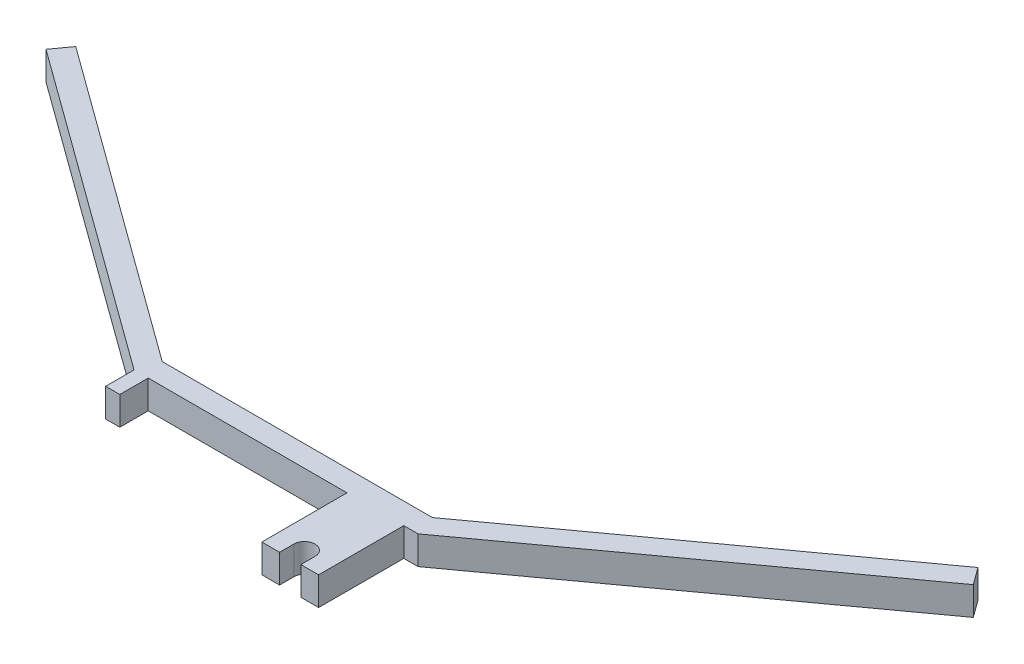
SolidWorks part; units mm, degrees
ref_plane "前视基准面" through (0, 0, 0) normal (0, 0, 1) x (1, 0, 0)
ref_plane "上视基准面" through (0, 0, 0) normal (0, 1, 0) x (1, 0, 0)
ref_plane "右视基准面" through (0, 0, 0) normal (1, 0, 0) x (0, 0, -1)
sketch "草图1" plane through (0, 0, 0) normal (0, 1, 0) x (1, 0, 0)
  line L0 (0, 0) -> (0, -51.4782) construction
  line L1 (-31.7734, -28.8317) -> (-9.5127, -45)
  line L2 (-9.5127, -45) -> (9.5127, -45)
  line L3 (-31.7734, -28.8317) -> (-32.6549, -30.0454)
  line L4 (-32.6549, -30.0454) -> (-10, -46.5)
  line L5 (-10, -46.5) -> (10, -46.5)
  line L6 (31.7734, -28.8317) -> (32.6549, -30.0454)
  line L7 (31.7734, -28.8317) -> (9.5127, -45)
  line L8 (32.6549, -30.0454) -> (10, -46.5)
  circle A0 centre (0, 0) radius 42 construction
  point P8 (0, -42)
  point P14 (0, -46.5)
  point P15 (0, -45)
  dimension "D1" = 84
  dimension "D2" = 20
  dimension "D3" = 3
  dimension "D4" = 1.5
  dimension "D5" = 1.5
  dimension "D6" = 28
extrude "凸台-拉伸1" add sketch "草图1" along normal mid plane 2
sketch "草图2" plane through (0, 1, 0) normal (0, 1, 0) x (1, 0, 0)
  line L0 (0, -45) -> (0, -49.7255) construction
  line L1 (9.5127, -45) -> (-9.5127, -45) construction
  line L2 (-10, -46.5) -> (10, -46.5) construction
  line L3 (-10, -46.5) -> (-9, -46.5)
  line L4 (-10, -46.5) -> (-10, -48.5)
  line L5 (-10, -48.5) -> (-9, -48.5)
  line L6 (-9, -46.5) -> (-9, -48.5)
  line L7 (10, -48.5) -> (9, -48.5)
  line L8 (9, -46.5) -> (9, -48.5)
  line L9 (10, -46.5) -> (9, -46.5)
  line L10 (10, -46.5) -> (10, -48.5)
  point P11 (-9.5, -48.5)
  dimension "D1" = 1
  dimension "D2" = 2
extrude "凸台-拉伸2" add sketch "草图2" against normal up to surface (2 mm away)
sketch "草图3" plane through (0, -1, 0) normal (0, -1, 0) x (1, 0, 0)
  line L0 (9, 46.5) -> (12.3635, 46.5)
  line L1 (12.3635, 46.5) -> (12.3635, 49.6079)
  line L2 (12.3635, 49.6079) -> (7.4973, 49.6079)
  line L3 (7.4973, 49.6079) -> (7.4973, 46.5)
  line L4 (-9, 46.5) -> (9, 46.5) construction
  line L5 (7.4973, 46.5) -> (9, 46.5)
extrude "切除-拉伸1" cut sketch "草图3" against normal through all
sketch "草图4" plane through (0, -1, 0) normal (0, -1, 0) x (1, 0, 0)
  line L0 (9, 46.5) -> (9, 52.5)
  line L1 (-9, 46.5) -> (10, 46.5) construction
  line L2 (9, 52.5) -> (5, 52.5)
  line L3 (5, 52.5) -> (5, 46.5)
  line L4 (10, 46.5) -> (10, 52.5069) construction
  line L5 (5, 46.5) -> (9, 46.5)
  dimension "D1" = 4
  dimension "D2" = 1
  dimension "D3" = 6
extrude "凸台-拉伸3" add sketch "草图4" against normal up to surface (2 mm away)
sketch "草图5" plane through (0, -1, 0) normal (0, -1, 0) x (1, 0, 0)
  line L0 (6.25, 51.5) -> (6.25, 54.5)
  line L1 (6.25, 54.5) -> (7.75, 54.5)
  line L2 (7.75, 54.5) -> (7.75, 51.5)
  line L3 (7, 52.5) -> (7, 51.5) construction
  line L4 (9, 52.5) -> (5, 52.5) construction
  arc A0 (6.25, 51.5) -> (7.75, 51.5) centre (7, 51.5) ccw
  dimension "D1" = 1.5
  dimension "D2" = 3
  dimension "D3" = 1
extrude "切除-拉伸2" cut sketch "草图5" against normal through all
